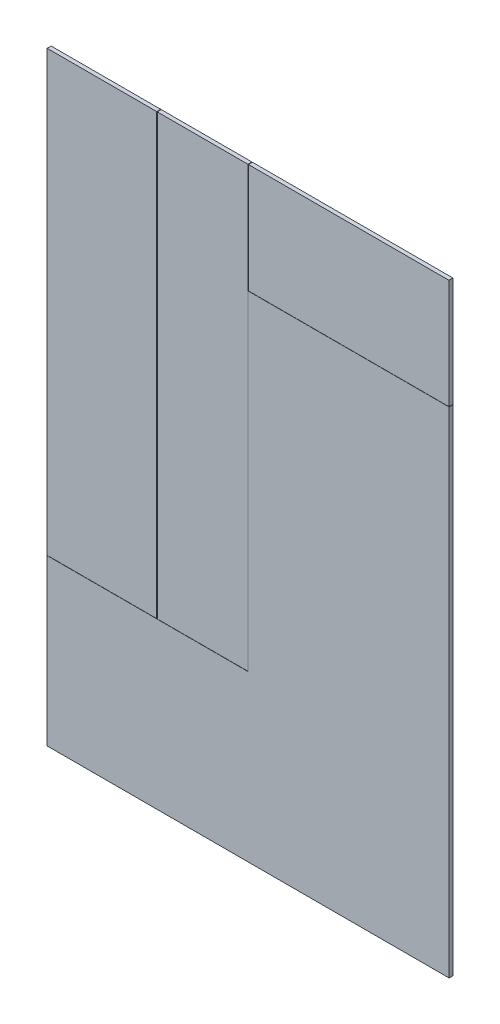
SolidWorks part; units mm, degrees
ref_plane "Plano frontal" through (0, 0, 0) normal (0, 0, 1) x (1, 0, 0)
ref_plane "Plano superior" through (0, 0, 0) normal (0, 1, 0) x (1, 0, 0)
ref_plane "Plano direito" through (0, 0, 0) normal (1, 0, 0) x (0, 0, -1)
sketch "Esboço1" plane through (0, 0, 0) normal (0, 0, 1) x (1, 0, 0)
  line L1 (0, 0) -> (-1830, 0)
  line L2 (0, 0) -> (0, 2750)
  line L3 (0, 2750) -> (-1830, 2750)
  line L4 (-1830, 0) -> (-1830, 2750)
  line L5 (0, 0) -> (-1830, 2750) construction
  line L6 (0, 2750) -> (-1830, 0) construction
  point P4 (-915, 1375)
extrude "Ressalto-extrusão1" add sketch "Esboço1" along normal blind 18
sketch "Esboço2" plane through (0, 0, 18) normal (0, 0, 1) x (1, 0, 0)
  line L0 (-1830, 1328.4582) -> (-1830, 51328.4582) construction
  line L1 (-2830, 250) -> (47170, 250) construction
  line L2 (-1328, 2749) -> (-916, 2749)
  line L3 (-2830, 200) -> (47170, 200) construction
  line L4 (-914, 1328.4582) -> (-914, 51328.4582) construction
  line L5 (-2830, 750) -> (47170, 750) construction
  line L6 (-913, 1328.4582) -> (-913, 51328.4582) construction
  line L7 (-1329, 2750) -> (-915, 2750)
  line L8 (-2830, 150) -> (47170, 150) construction
  line L9 (-2830, 2250) -> (-1830, 2250) construction
  line L10 (-2, 1585.2309) -> (-2, 51585.2309) construction
  line L11 (-915, 2250) -> (47170, 2250) construction
  line L12 (-1049.9576, 2750) -> (48950.0424, 2750) construction
  line L13 (-915, 1750) -> (47170, 1750) construction
  line L14 (-915, 1250) -> (47170, 1250) construction
  line L15 (-2830, 100) -> (47170, 100) construction
  line L16 (-2830, 50) -> (47170, 50) construction
  line L17 (-1829, 2749) -> (-1331, 2749)
  line L18 (-1830, 2750) -> (-1330, 2750)
  line L19 (-1830, 2750) -> (-1830, 750)
  line L20 (-1830, 750) -> (-1330, 750)
  line L21 (-1330, 2750) -> (-1330, 750)
  line L22 (-1331, 2749) -> (-1331, 751)
  line L23 (-1829, 751) -> (-1331, 751)
  line L24 (-1829, 2749) -> (-1829, 751)
  line L25 (-1329, 750) -> (-1329, 51328.4582) construction
  line L26 (-1329, 2750) -> (-1329, 750)
  line L27 (-1329, 750) -> (-915, 750)
  line L28 (-915, 2750) -> (-915, 750)
  line L29 (-1329, 2750) -> (-915, 750) construction
  line L30 (-1329, 750) -> (-915, 2750) construction
  line L31 (-916, 2749) -> (-916, 751)
  line L32 (-1328, 751) -> (-916, 751)
  line L33 (-1328, 2749) -> (-1328, 751)
  line L35 (-1, 1585.2309) -> (-1, 51585.2309) construction
  line L36 (-1049.9576, 2749) -> (48950.0424, 2749) construction
  line L37 (-915, 2251) -> (47170, 2251) construction
  line L38 (0, 0) -> (0, 2750) construction
  line L39 (-914, 2750) -> (0, 2750)
  line L40 (-914, 2750) -> (-914, 2250)
  line L41 (-914, 2250) -> (0, 2250)
  line L42 (0, 2750) -> (0, 2250)
  line L43 (-914, 2750) -> (0, 2250) construction
  line L44 (-914, 2250) -> (0, 2750) construction
  line L46 (-1, 2251) -> (-913, 2251)
  line L47 (-1, 2251) -> (-1, 2749)
  line L48 (-1, 2749) -> (-913, 2749)
  line L49 (-913, 2251) -> (-913, 2749)
  line L50 (-1, 2251) -> (-913, 2749) construction
  line L51 (-1, 2749) -> (-913, 2251) construction
  point P36 (-1580, 1750)
  point P43 (-1122, 1750)
  point P60 (-457, 2500)
  point P67 (-457, 2500)
  dimension "D1" = 50
  dimension "D2" = 50
  dimension "D3" = 1
  dimension "D4" = 1
  dimension "D5" = 500
  dimension "D6" = 1
  dimension "D7" = 500
  dimension "D8" = 500
  dimension "D9" = 50
  dimension "D10" = 50
  dimension "D11" = 1
  dimension "D12" = 1
  dimension "D13" = 1
extrude "Corte-extrusão1" cut sketch "Esboço2" against normal blind 18
